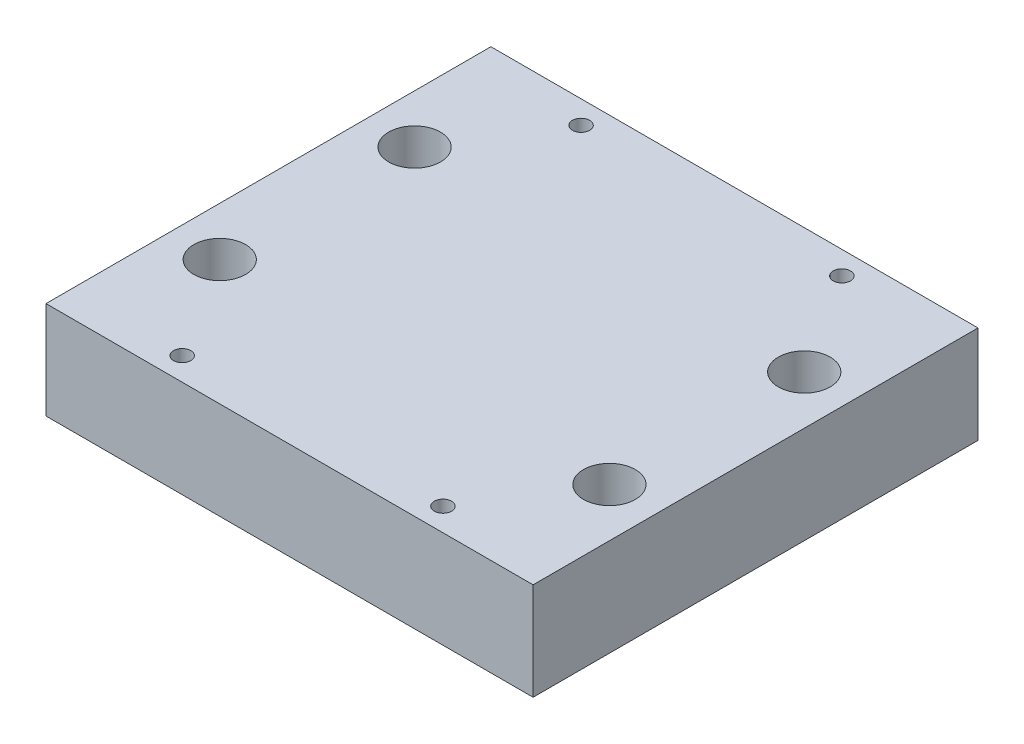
SolidWorks part; units mm, degrees
ref_plane "Front Plane" through (0, 0, 0) normal (0, 0, 1) x (1, 0, 0)
ref_plane "Top Plane" through (0, 0, 0) normal (0, 1, 0) x (1, 0, 0)
ref_plane "Right Plane" through (0, 0, 0) normal (1, 0, 0) x (0, 0, -1)
sketch "Sketch1" plane through (0, 0, 0) normal (0, 1, 0) x (1, 0, 0)
  line L1 (-31.75, -29) -> (31.75, -29)
  line L2 (-31.75, -29) -> (-31.75, 29)
  line L3 (-31.75, 29) -> (31.75, 29)
  line L4 (31.75, -29) -> (31.75, 29)
  line L5 (-31.75, -29) -> (31.75, 29) construction
  line L6 (-31.75, 29) -> (31.75, -29) construction
  point P0 (0, 0)
  dimension "D1" = 58
  dimension "D2" = 63.5
extrude "Boss-Extrude1" add sketch "Sketch1" along normal blind 12.7 contours L3 L4 L1 L2
hole_wizard "#4-40 Tapped Hole1" positions "Sketch2" profile "Sketch3" tap size "#4-40" standard "ANSI Inch"
sketch "Sketch2" plane through (0, 12.7, 0) normal (0, 1, 0) x (1, 0, 0)
  point P0 (-17, 26)
  point P2 (17, 26)
  point P4 (17, -26)
  point P6 (-17, -26)
  dimension "D1" = 34
  dimension "D2" = 52
  dimension "D3" = 34
  dimension "D4" = 17
  dimension "D5" = 26
sketch "Sketch3" plane through (-17, 12.7, -26) normal (1, 0, 0) x (0, 0, 1)
  line L0 (0, 0) -> (0, 7.0292)
  line L1 (0, 7.0292) -> (1.1303, 6.35)
  line L2 (1.1303, 6.35) -> (1.1303, 0)
  line L5 (1.1303, 0) -> (0, 0)
  line L10 (0, 7.0292) -> (-1.1303, 6.35) construction
  line L11 (0, -6.35) -> (0, 107.95) construction
  dimension "Tap Drill Dia." = 2.2606
  dimension "Tap Drill Depth" = 6.35
  dimension "Drill Angle" = 118
hole_wizard "H (0.266) Diameter Hole1" positions "Sketch6" profile "Sketch7" hole size "H" standard "ANSI Inch"
sketch "Sketch6" plane through (0, 12.7, 0) normal (0, 1, 0) x (1, 0, 0)
  point P0 (-25.4, 12.7)
  point P2 (25.4, 12.7)
  point P6 (-25.4, -12.7)
  point P21 (25.4, -12.7)
  dimension "D2" = 50.8
  dimension "D3" = 25.4
  dimension "D4" = 25.4
  dimension "D5" = 12.7
  dimension "D7" = 0
sketch "Sketch7" plane through (-25.4, 12.7, -12.7) normal (1, 0, 0) x (0, 0, 1)
  line L0 (0, 0) -> (0, 12.7)
  line L1 (0, 12.7) -> (3.3782, 12.7)
  line L2 (3.3782, 12.7) -> (3.3782, 0)
  line L5 (3.3782, 0) -> (0, 0)
  line L11 (0, -6.35) -> (0, 107.95) construction
  dimension "Thru Hole Dia." = 6.7564
  dimension "Thru Hole Depth" = 12.7
